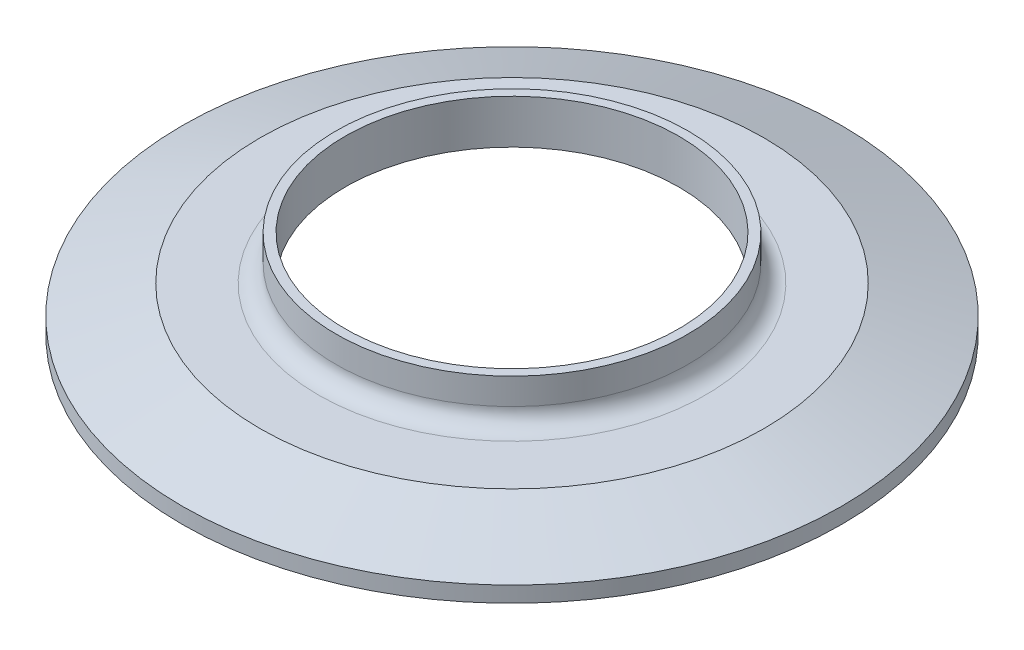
SolidWorks part; units mm, degrees
ref_plane "Front Plane" through (0, 0, 0) normal (0, 0, 1) x (1, 0, 0)
ref_plane "Top Plane" through (0, 0, 0) normal (0, 1, 0) x (1, 0, 0)
ref_plane "Right Plane" through (0, 0, 0) normal (1, 0, 0) x (0, 0, -1)
sketch "Sketch1" plane through (0, 0, 0) normal (0, 0, 1) x (1, 0, 0)
  line L0 (0, 0) -> (0, 8.8532) construction
  line L1 (-31.75, 15.875) -> (-31.75, 11.1252)
  line L2 (-34.925, 7.9502) -> (-45.4344, 7.9502)
  line L3 (-45.4344, 7.9502) -> (-59.4614, 2.8448)
  line L4 (-59.4614, 2.8448) -> (-59.4614, 0)
  line L5 (-59.4614, 0) -> (-56.9249, 0)
  line L6 (-48.6918, 0) -> (-52.8099, 0)
  line L10 (-48.6918, 0) -> (-30.099, 7.9228)
  line L11 (-30.099, 7.9228) -> (-30.099, 15.875)
  line L12 (-30.099, 15.875) -> (-31.75, 15.875)
  line L15 (-55.8994, 0.8729) -> (-56.0708, 0.4691)
  line L17 (-53.7016, 0.8729) -> (-53.5347, 0.4797)
  arc A0 (-34.925, 7.9502) -> (-31.75, 11.1252) centre (-34.925, 11.1252) ccw
  arc A1 (-56.0708, 0.4691) -> (-56.9249, 0) centre (-56.7956, 0.7767) cw
  arc A2 (-52.8099, 0) -> (-53.5347, 0.4797) centre (-52.8099, 0.7874) cw
  arc A3 (-53.7016, 0.8729) -> (-55.8994, 0.8729) centre (-54.8005, 0.4064) ccw
  dimension "D3" = 3.175
  dimension "D7" = 0.7874
  dimension "D8" = 54.8005
  dimension "D9" = 0.7874
  dimension "D15" = 1.1938
  dimension "D2" = 30.099
  dimension "D4" = 15.875
  dimension "D5" = 7.9502
  dimension "D6" = 59.4614
  dimension "D10" = 20
  dimension "D11" = 48.6918
  dimension "D12" = 31.75
  dimension "D13" = 2.8448
  dimension "D14" = 66.92
  dimension "D16" = 0.4064
  dimension "D17" = 46
  dimension "D18" = 2.8448
revolve "Revolve1" add sketch "Sketch1" angle 360 about L0
